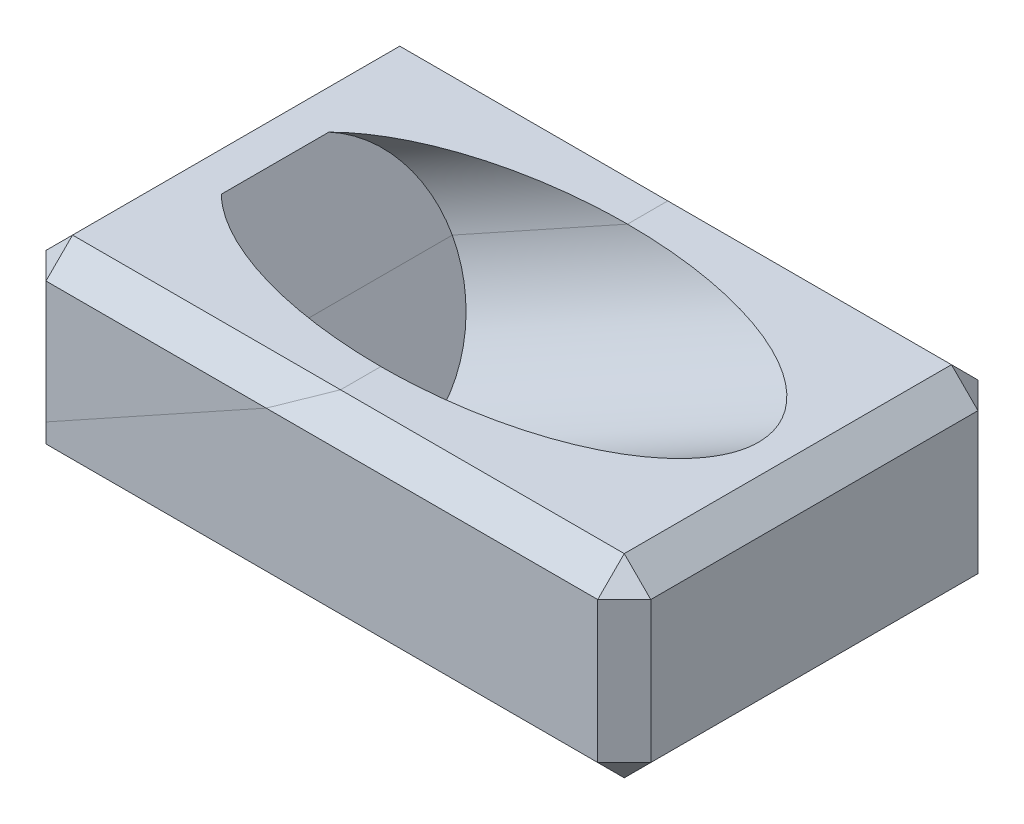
SolidWorks part; units mm, degrees
ref_plane "Front Plane" through (0, 0, 0) normal (0, 0, 1) x (1, 0, 0)
ref_plane "Top Plane" through (0, 0, 0) normal (0, 1, 0) x (1, 0, 0)
ref_plane "Right Plane" through (0, 0, 0) normal (1, 0, 0) x (0, 0, -1)
sketch "Sketch1" plane through (0, 0, 0) normal (0, 1, 0) x (1, 0, 0)
  line L1 (-114, 71.68) -> (114, 71.68)
  line L2 (-114, 71.68) -> (-114, -71.68)
  line L3 (-114, -71.68) -> (114, -71.68)
  line L4 (114, 71.68) -> (114, -71.68)
  line L5 (-114, 71.68) -> (114, -71.68) construction
  line L6 (-114, -71.68) -> (114, 71.68) construction
  point P0 (0, 0)
  dimension "D1" = 228
  dimension "D2" = 143.36
extrude "Boss-Extrude1" add sketch "Sketch1" along normal blind 73.22 contours L4 L3 L2 L1
chamfer "Chamfer1" distance 10 angle 45 12 edges at (0, 73.22, 71.68) (0, 73.22, -71.68) (114, 36.61, 71.68) (114, 73.22, 0) (114, 36.61, -71.68) (0, 0, 71.68) (114, 0, 0) (0, 0, -71.68) (-114, 36.61, -71.68) (-114, 73.22, 0) (-114, 36.61, 71.68) (-114, 0, 0)
other "Cavity1"
other "Arm slot clutter<1>@Assem1"
ref_plane "Plane1" through (-31.7413, 57.2628, 0) normal (-0.4848, 0.8746, 0) x (0.8746, 0.4848, 0)
split "Split1" trim tools "Plane1" bodies to split 103 resulting bodies 104 105
